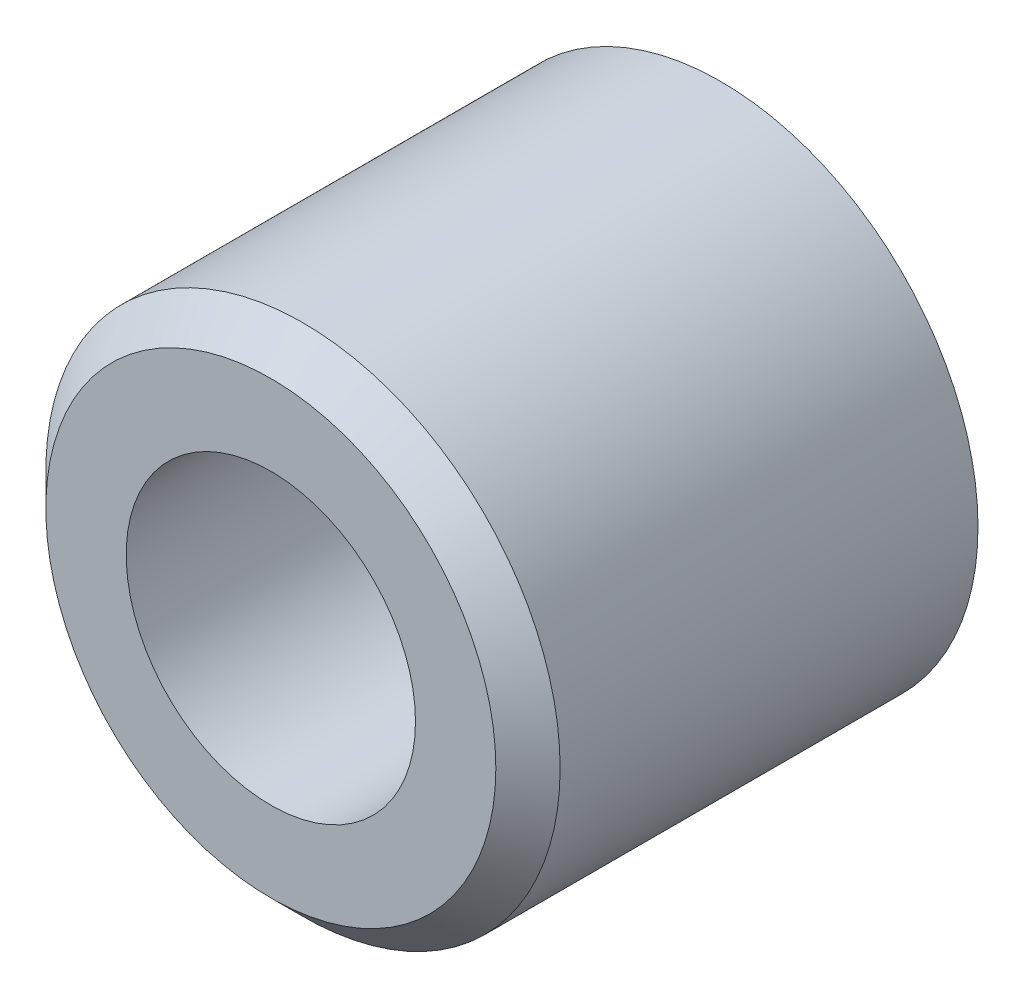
SolidWorks part; units mm, degrees
ref_plane "Face" through (0, 0, 0) normal (0, 0, 1) x (1, 0, 0)
ref_plane "Dessus" through (0, 0, 0) normal (0, 1, 0) x (1, 0, 0)
ref_plane "Droite" through (0, 0, 0) normal (1, 0, 0) x (0, 0, -1)
sketch "Esquisse1" plane through (0, 0, 0) normal (0, 0, 1) x (1, 0, 0)
  circle A0 centre (0, 0) radius 4
  circle A1 centre (0, 0) radius 2.25
  dimension "D1" = 4.5
  dimension "D2" = 8
extrude "Boss.-Extru.1" add sketch "Esquisse1" along normal blind 7
chamfer "Chanfrein1" distance 0.5 angle 45 1 edges at (4, 0, 7)
